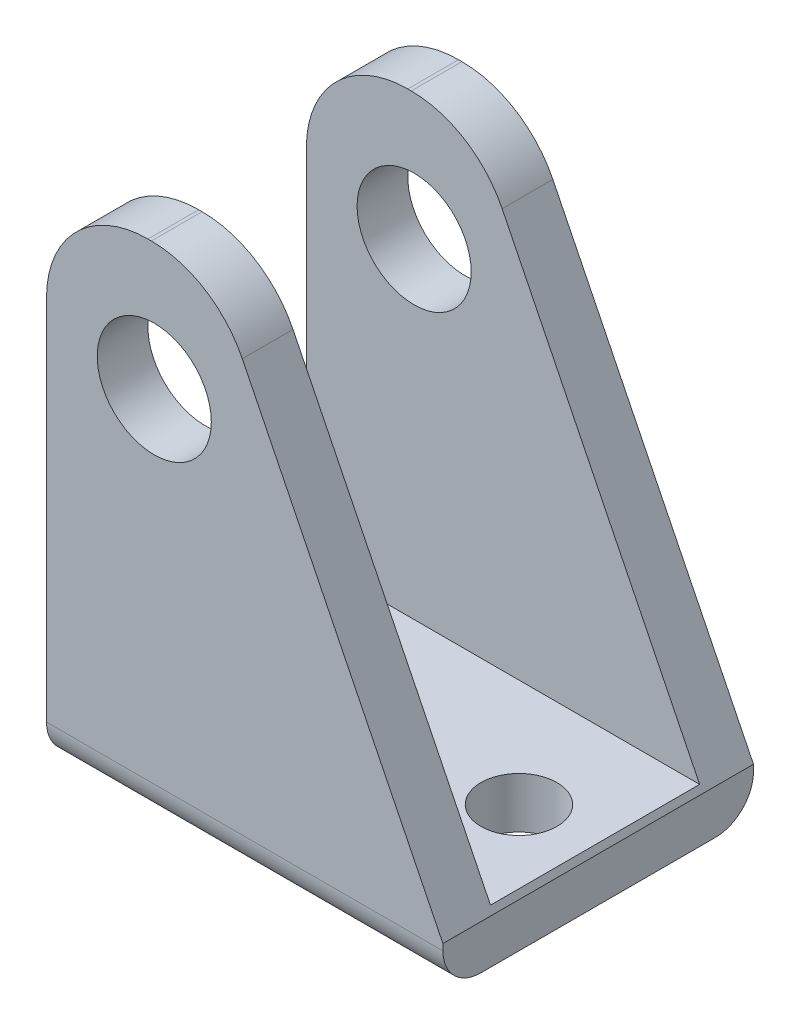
SolidWorks part; units mm, degrees
ref_plane "Plan de face" through (0, 0, 0) normal (0, 0, 1) x (1, 0, 0)
ref_plane "Plan de dessus" through (0, 0, 0) normal (0, 1, 0) x (1, 0, 0)
ref_plane "Plan de droite" through (0, 0, 0) normal (1, 0, 0) x (0, 0, -1)
sketch "Esquisse1" plane through (0, 0, 0) normal (0, 0, 1) x (1, 0, 0)
  line L0 (0, 0) -> (0, 40)
  line L1 (0, 40) -> (13.2436, 40)
  line L2 (13.2436, 40) -> (33, 0)
  line L3 (33, 0) -> (0, 0)
  dimension "D1" = 40
  dimension "D2" = 33
  dimension "D3" = 19.7564
extrude "Extrusion1" add sketch "Esquisse1" along normal blind 24.5
fillet "Congé1" radius 8 2 edges at (13.2436, 40, 12.25) (0, 40, 12.25)
fillet "Congé2" radius 3 2 edges at (16.5, 0, 0) (16.5, 0, 24.5)
sketch "Esquisse3" plane through (0, 0, 24.5) normal (0, 0, 1) x (1, 0, 0)
  line L0 (33, 0) -> (0, 0) construction
  line L1 (0, 32) -> (0, 3) construction
  circle A0 centre (8.5, 30) radius 4.5
  dimension "D1" = 30
  dimension "D2" = 8.5
  dimension "D3" = 9
extrude "Enlèv. mat.-Extru.1" cut sketch "Esquisse3" against normal through all
sketch "Esquisse4" plane through (0, 40, 0) normal (0, 1, 0) x (1, 0, 0)
  line L0 (8, 0) -> (0, 0) construction
  line L1 (-1.9356, -4) -> (34.7467, -4)
  line L2 (-1.9356, -4) -> (-1.9356, -20.5)
  line L3 (-1.9356, -20.5) -> (34.7467, -20.5)
  line L4 (34.7467, -4) -> (34.7467, -20.5)
  line L6 (8.2723, -24.5) -> (15.4451, -24.5) construction
  dimension "D1" = 4
  dimension "D2" = 4
extrude "Enlèv. mat.-Extru.2" cut sketch "Esquisse4" against normal blind 36
sketch "Esquisse5" plane through (0, 4, 0) normal (0, 1, 0) x (1, 0, 0)
  line L1 (31.2711, 1.0856) -> (34.2556, 1.0856)
  line L2 (31.2711, 1.0856) -> (31.2711, -25.51)
  line L3 (31.2711, -25.51) -> (34.2556, -25.51)
  line L4 (34.2556, 1.0856) -> (34.2556, -25.51)
extrude "Enlèv. mat.-Extru.3" cut sketch "Esquisse5" against normal blind 36
sketch "Esquisse6" plane through (0, 4, 0) normal (0, 1, 0) x (1, 0, 0)
  line L5 (0, -24.5) -> (31.2711, -24.5) construction
  line L6 (0, -21.5) -> (0, -3) construction
  circle A0 centre (5.27, -12.5) radius 3
  circle A1 centre (25.27, -12.5) radius 3
  dimension "D1" = 6
  dimension "D2" = 6
  dimension "D3" = 12
  dimension "D4" = 12
  dimension "D6" = 5.27
  dimension "D5" = 20
extrude "Enlèv. mat.-Extru.4" cut sketch "Esquisse6" against normal blind 36
